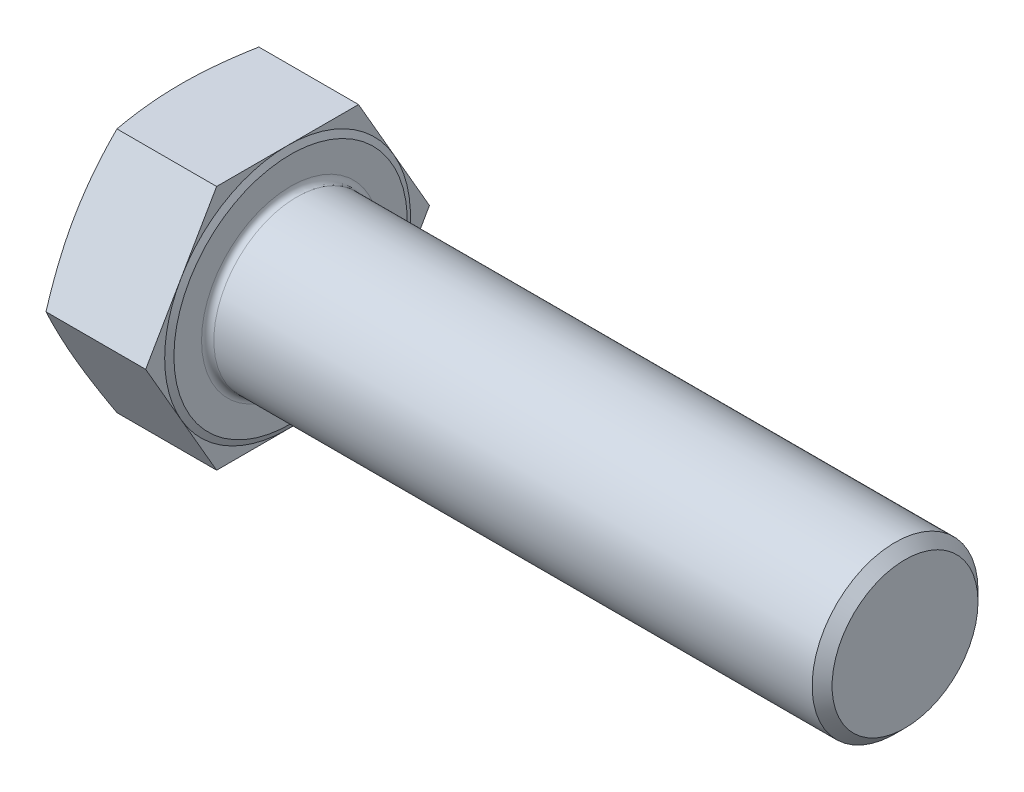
SolidWorks part; units mm, degrees
ref_plane "Front" through (0, 0, 0) normal (0, 0, 1) x (1, 0, 0)
ref_plane "Top" through (0, 0, 0) normal (0, 1, 0) x (1, 0, 0)
ref_plane "Right" through (0, 0, 0) normal (1, 0, 0) x (0, 0, -1)
sketch "Sketch-BaseHead" plane through (0, 0, 0) normal (1, 0, 0) x (0, 0, -1)
  line L1 (23.094, 0) -> (11.547, 20)
  line L2 (11.547, 20) -> (-11.547, 20)
  line L3 (-11.547, 20) -> (-23.094, 0)
  line L4 (-23.094, 0) -> (-11.547, -20)
  line L5 (-11.547, -20) -> (11.547, -20)
  line L6 (11.547, -20) -> (23.094, 0)
  circle A0 centre (0, 0) radius 20 construction
  dimension "s" = 40
extrude "BaseHead" add sketch "Sketch-BaseHead" along normal blind 17.35
sketch "Sketch4" plane through (-0.2646, 0, 5.9169) normal (0, 1, 0) x (0, 0, -1)
  line L0 (5.9169, 3.7369) -> (5.9169, -10.4477) construction
  line L2 (29.0109, -0.2646) -> (25.9169, -0.2646)
  line L4 (25.9169, -0.2646) -> (29.0109, -1.3908)
  line L6 (29.0109, -1.3908) -> (29.0109, -0.2646)
  dimension "D1" = 20
  dimension "D2" = 40
revolve "HeadChamfer" cut sketch "Sketch4" angle 360 about L0
sketch "Sketch1" plane through (0, 0, 0) normal (0, 0, 1) x (1, 0, 0)
  line L0 (17.35, 0) -> (17.85, 0)
  line L1 (17.85, 0) -> (17.85, -19)
  line L2 (17.85, -19) -> (17.35, -20)
  line L3 (17.35, -20) -> (17.35, 0) construction
  line L4 (0, 0) -> (7.5821, 0) construction
  line L5 (-4.0016, 0) -> (10.1831, 0) construction
  line L6 (17.35, -20) -> (1.1261, -20) construction
  line L7 (17.35, 0) -> (17.35, -20)
  dimension "D1" = 20
  dimension "c" = 0.5
  dimension "D2" = 19
revolve "Revolve1" add sketch "Sketch1" angle 360 about axis through (-4.0016, 0, 0) along (1, 0, 0)
ref_plane "Plane2" through (57.85, 0, 0) normal (1, 0, 0) x (0, 0, -1)
sketch "Sketch3" plane through (17.85, 0, 0) normal (1, 0, 0) x (0, 0, -1)
  circle A0 centre (0, 0) radius 13.5
  dimension "d" = 27
extrude "BaseBody" add sketch "Sketch3" along normal blind 100
fillet "HeadFillet" radius 1 1 edges at (17.85, 0, -13.5)
chamfer "Chamfer1" distance 1.624 angle 45 1 edges at (117.85, 0, -13.5)
equation "\"D1@Sketch1\" = \"s@Sketch-BaseHead\"/ 2"
equation "\"D2@Sketch4\" = \"s@Sketch-BaseHead\""
equation "\"D1@Chamfer1\" =  ( \"d@Sketch3\" - \"D2@ThreadCosmetic1\" ) / 2 "
equation "\"b@ThreadCosmetic1\" = \"l@BaseBody\" - \"lg@Plane2\""
